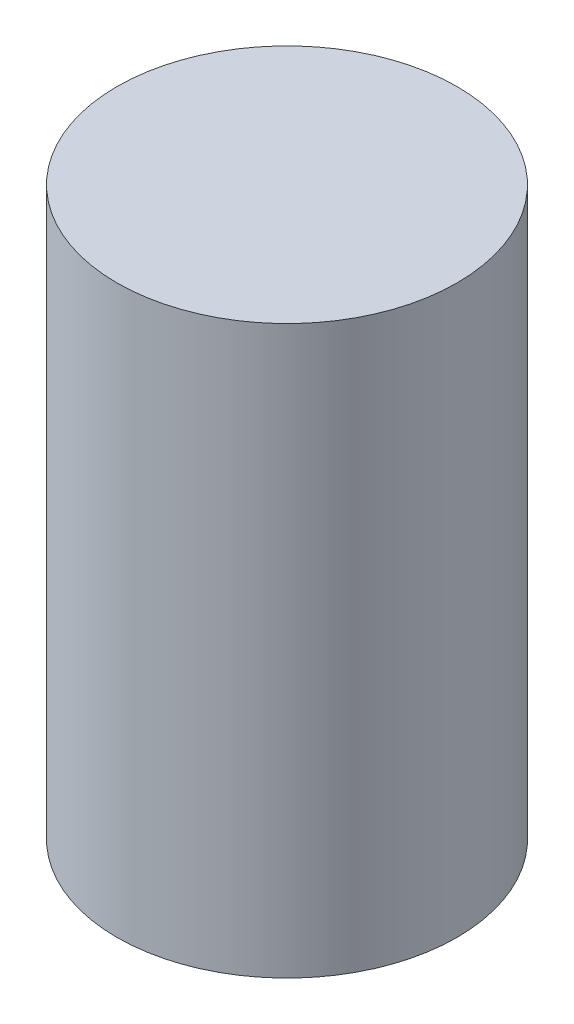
SolidWorks part; units mm, degrees
ref_plane "前视基准面" through (0, 0, 0) normal (0, 0, 1) x (1, 0, 0)
ref_plane "上视基准面" through (0, 0, 0) normal (0, 1, 0) x (1, 0, 0)
ref_plane "右视基准面" through (0, 0, 0) normal (1, 0, 0) x (0, 0, -1)
sketch "草图1" plane through (0, 0, 0) normal (0, 1, 0) x (1, 0, 0)
  circle A0 centre (0, 0) radius 15
  dimension "D1" = 30
extrude "拉伸1" add sketch "草图1" along normal blind 50
